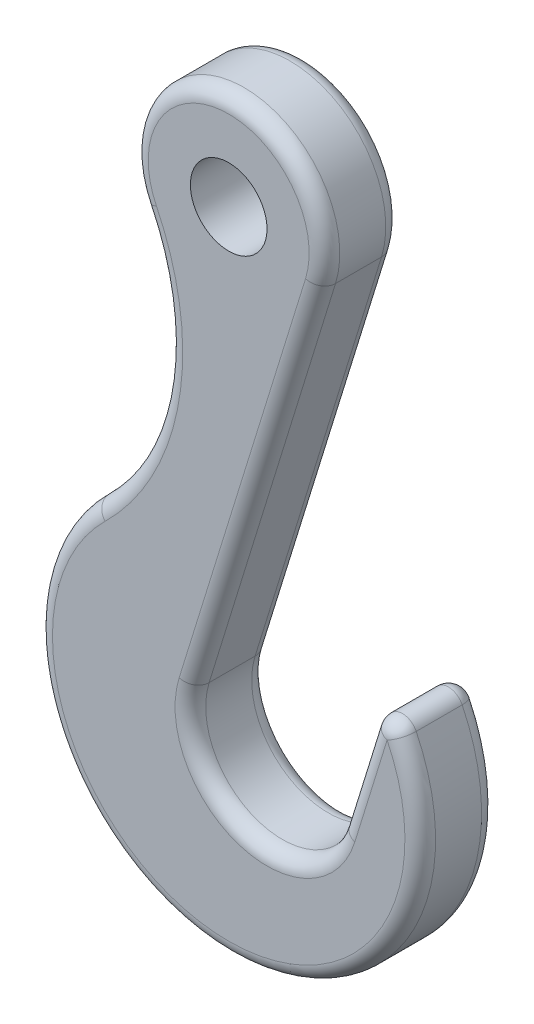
SolidWorks part; units mm, degrees
ref_plane "正面" through (0, 0, 0) normal (0, 0, 1) x (1, 0, 0)
ref_plane "平面" through (0, 0, 0) normal (0, 1, 0) x (1, 0, 0)
ref_plane "右側面" through (0, 0, 0) normal (1, 0, 0) x (0, 0, -1)
sketch "layout1" plane through (0, 0, 0) normal (0, 0, 1) x (1, 0, 0)
  line L0 (0, 0) -> (0, 60) construction
  line L1 (0, 0) -> (5, 0) construction
  circle A0 centre (0, 60) radius 12.5
  circle A1 centre (0, 0) radius 25
  circle A2 centre (5, 0) radius 10
  dimension "D3" = 50
  dimension "D4" = 20
  dimension "D5" = 25
  dimension "D1" = 60
  dimension "D2" = 5
sketch "layout2" plane through (0, 0, 0) normal (0, 0, 1) x (1, 0, 0)
  line L0 (0, 0) -> (0, 60) construction
  circle A0 centre (-39.834, 40.5383) radius 31.834
  circle A1 centre (0, 60) radius 12.5 construction
  circle A2 centre (0, 0) radius 25 construction
  dimension "D1" = 8
sketch "ｽｹｯﾁ3" plane through (0, 0, 0) normal (0, 0, 1) x (1, 0, 0)
  line L0 (11.9422, 56.3077) -> (-4.5538, 2.9539)
  line L1 (14.5538, -2.9539) -> (20.0741, 14.9007)
  circle A4 centre (0, 60) radius 12.5 construction
  circle A5 centre (-39.834, 40.5383) radius 31.834 construction
  circle A6 centre (5, 0) radius 10 construction
  circle A7 centre (0, 0) radius 25 construction
  arc A8 (11.9422, 56.3077) -> (-11.2312, 54.5128) centre (0, 60) ccw
  arc A9 (-17.5221, 17.8319) -> (-11.2312, 54.5128) centre (-39.834, 40.5383) ccw
  arc A10 (-4.5538, 2.9539) -> (14.5538, -2.9539) centre (5, 0) ccw
  arc A11 (-17.5221, 17.8319) -> (20.0741, 14.9007) centre (0, 0) ccw
extrude "押し出し1" add sketch "ｽｹｯﾁ3" along normal blind 10
sketch "ｽｹｯﾁ4" plane through (0, 0, 0) normal (0, 0, 1) x (1, 0, 0)
  circle A0 centre (0, 60) radius 5
  dimension "D1" = 10
extrude "ｶｯﾄ - 押し出し1" cut sketch "ｽｹｯﾁ4" along normal through all
fillet "ﾌｨﾚｯﾄ1" radius 2 1 edges at (20.0741, 14.9007, 5)
fillet "ﾌｨﾚｯﾄ2" radius 2 14 edges at (-8.4581, 35.1573, 0) (-0.9653, 72.4627, 0) (3.6942, 29.6308, 0) (2.0461, -9.5538, 0) (16.6593, 3.8563, 0) (20.5222, 12.0697, 0) (16.6593, 3.8563, 10) (20.5222, 12.0697, 10) (-4.2383, -24.6381, 10) (-8.4581, 35.1573, 10) (-0.9653, 72.4627, 10) (3.6942, 29.6308, 10) (-4.2383, -24.6381, 0) (2.0461, -9.5538, 10)
